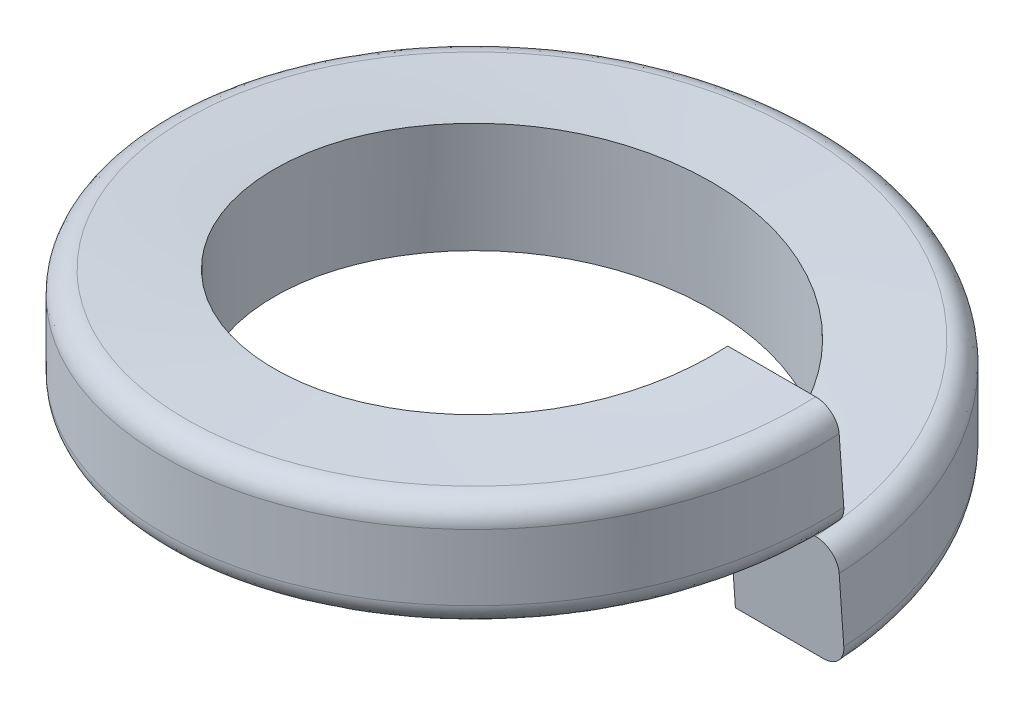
SolidWorks part; units mm, degrees
ref_plane "前视基准面" through (0, 0, 0) normal (0, 0, 1) x (1, 0, 0)
ref_plane "上视基准面" through (0, 0, 0) normal (0, 1, 0) x (1, 0, 0)
ref_plane "右视基准面" through (0, 0, 0) normal (1, 0, 0) x (0, 0, -1)
sketch "草图1" plane through (0, 0, 0) normal (0, 1, 0) x (1, 0, 0)
  circle A0 centre (0, 0) radius 2.5
  dimension "D1" = 5
curve "螺旋线/涡状线1"
ref_plane "基准面1" through (2.5, -1.1, 0) normal (0, -0.0699, 0.9976) x (1, 0, 0)
sketch "草图2" plane through (2.5, -1.1, 0) normal (0, -0.0699, 0.9976) x (1, 0, 0)
  line L0 (-0.0024, 0.0057) -> (-0.0024, 4.0446) construction
  line L1 (-0.0024, 4.0446) -> (-0.0024, -3.8367) construction
  line L2 (-0.0024, 0.0057) -> (3.0305, 0.0057) construction
  line L3 (3.0305, 0.0057) -> (-2.932, 0.0057) construction
  line L5 (-0.5024, 0.5057) -> (0.4976, 0.5057)
  line L6 (0.4976, 0.5057) -> (0.4976, -0.4943)
  line L7 (0.4976, -0.4943) -> (-0.5024, -0.4943)
  line L8 (-0.5024, 0.5057) -> (-0.5024, -0.4943)
  point P10 (-0.0024, -0.4943)
sweep "扫描3" add profiles "草图2" path "螺旋线/涡状线1"
fillet "圆角1" radius 0.2 2 edges
